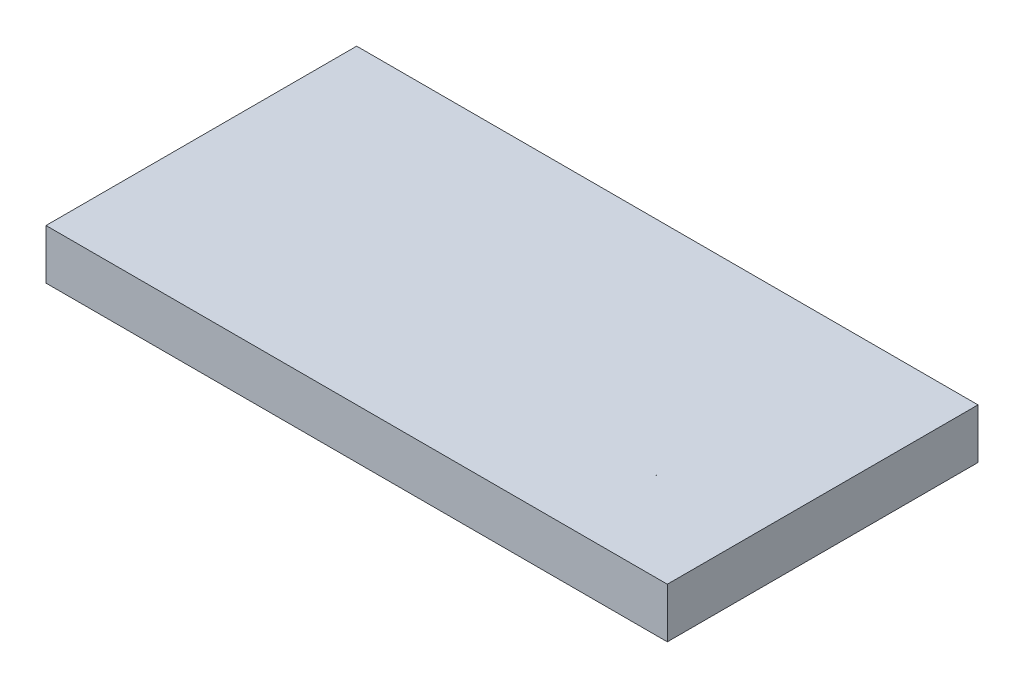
SolidWorks part; units mm, degrees
ref_plane "Front" through (0, 0, 0) normal (0, 0, 1) x (1, 0, 0)
ref_plane "Top" through (0, 0, 0) normal (0, 1, 0) x (1, 0, 0)
ref_plane "Right" through (0, 0, 0) normal (1, 0, 0) x (0, 0, -1)
sketch "Sketch1" plane through (0, 0, 0) normal (0, 0, 1) x (1, 0, 0)
  line L1 (-177.8, 15.875) -> (177.8, 15.875)
  line L2 (-177.8, 15.875) -> (-177.8, 0)
  line L3 (-177.8, 0) -> (177.8, 0)
  line L4 (177.8, 15.875) -> (177.8, 0)
  dimension "D1" = 15.875
  dimension "D2" = 355.6
extrude "Base-Extrude" add sketch "Sketch1" against normal mid plane 177.8
sketch "Sketch6" plane through (0, 0, 0) normal (0, -1, 0) x (1, 0, 0)
  line L8 (152.4, 63.5) -> (-152.4, 63.5)
  line L9 (-152.4, 63.5) -> (-152.4, -63.5)
  line L10 (-152.4, -63.5) -> (152.4, -63.5)
  line L11 (152.4, -63.5) -> (152.4, 63.5)
  line L12 (152.4, 63.5) -> (-152.4, 63.5)
  line L13 (-152.4, 63.5) -> (-152.4, -63.5)
  line L14 (-152.4, -63.5) -> (152.4, -63.5)
  line L15 (152.4, -63.5) -> (152.4, 63.5)
  line L20 (177.8, 88.9) -> (-177.8, 88.9)
  line L21 (-177.8, 88.9) -> (-177.8, -88.9)
  line L22 (-177.8, -88.9) -> (177.8, -88.9)
  line L23 (177.8, -88.9) -> (177.8, 88.9)
  line L24 (177.8, 88.9) -> (-177.8, 88.9)
  line L25 (-177.8, 88.9) -> (-177.8, -88.9)
  line L26 (-177.8, -88.9) -> (177.8, -88.9)
  line L27 (177.8, -88.9) -> (177.8, 88.9)
  dimension "D1" = 25.4
  dimension "D2" = 0
extrude "Boss-Extrude1" add sketch "Sketch6" along normal blind 12.7
hole_wizard "#97 (0.005900) Diameter Hole1" positions "Sketch7" profile "Sketch8" hole size "#97" standard "Ansi Inch"
sketch "Sketch7" plane through (50.8, 25.4, 0) normal (0, 1, 0) x (-1, 0, 0)
  line L0 (0, 0) -> (0, -51.9276) construction
  line L2 (0, 0) -> (-40, 0) construction
  point P0 (69.85, 38.1)
  point P1 (69.85, -38.1)
  point P2 (-69.85, -38.1)
  point P3 (-69.85, 38.1)
sketch "Sketch8" plane through (-19.05, 25.4, 38.1) normal (1, 0, 0) x (0, 0, 1)
  line L0 (0, 0) -> (0, 38.1)
  line L1 (0, 38.1) -> (0.0749, 38.1)
  line L2 (0.0749, 38.1) -> (0.0749, 0)
  line L3 (0.0749, 0) -> (0, 0)
  line L4 (0, -6.35) -> (0, 107.95) construction
  dimension "Thru Hole Dia." = 0.1499
  dimension "Thru Hole Depth" = 38.1
